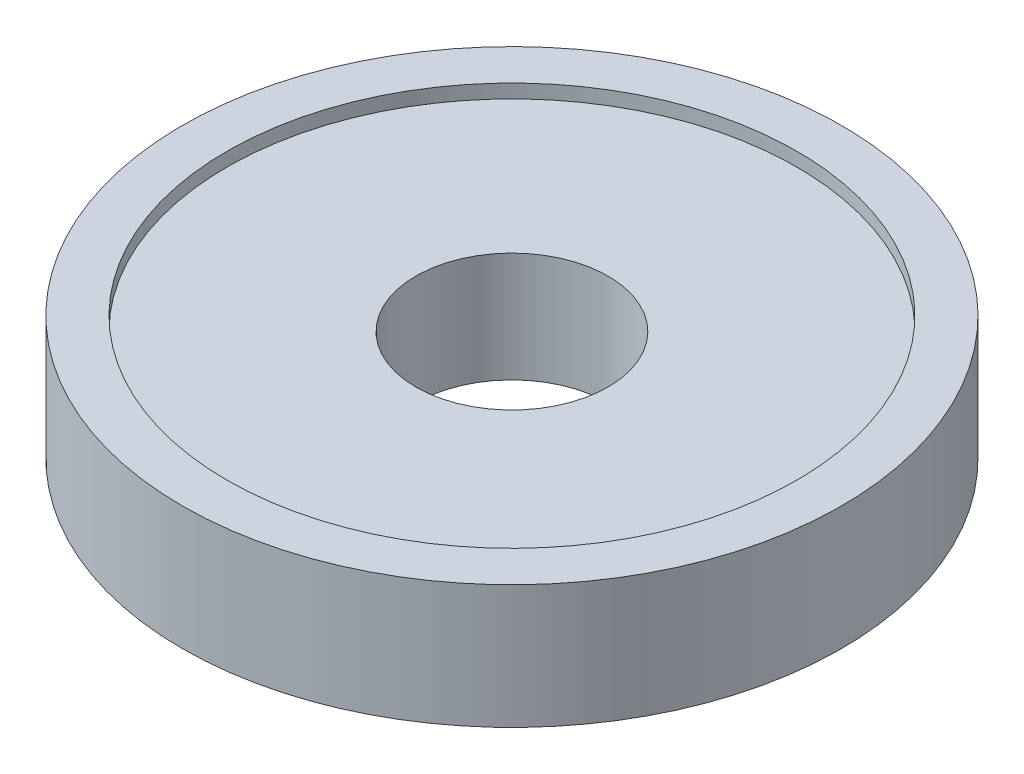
SolidWorks part; units mm, degrees
ref_plane "Front Plane" through (0, 0, 0) normal (0, 0, 1) x (1, 0, 0)
ref_plane "Top Plane" through (0, 0, 0) normal (0, 1, 0) x (1, 0, 0)
ref_plane "Right Plane" through (0, 0, 0) normal (1, 0, 0) x (0, 0, -1)
sketch "Sketch1" plane through (0, 0, 0) normal (0, 1, 0) x (1, 0, 0)
  line L0 (0, 48) -> (0, -48) construction
  line L1 (-48, 0) -> (48, 0) construction
  circle A0 centre (0, 0) radius 14
  circle A1 centre (0, 0) radius 48
  dimension "D1" = 28
  dimension "D2" = 96
extrude "Boss-Extrude1" add sketch "Sketch1" along normal mid plane 18
sketch "Sketch4" plane through (0, 9, 0) normal (0, 1, 0) x (1, 0, 0)
  circle A0 centre (0, 0) radius 41.5
  dimension "D1" = 83
extrude "Cut-Extrude1" cut sketch "Sketch4" against normal blind 2
